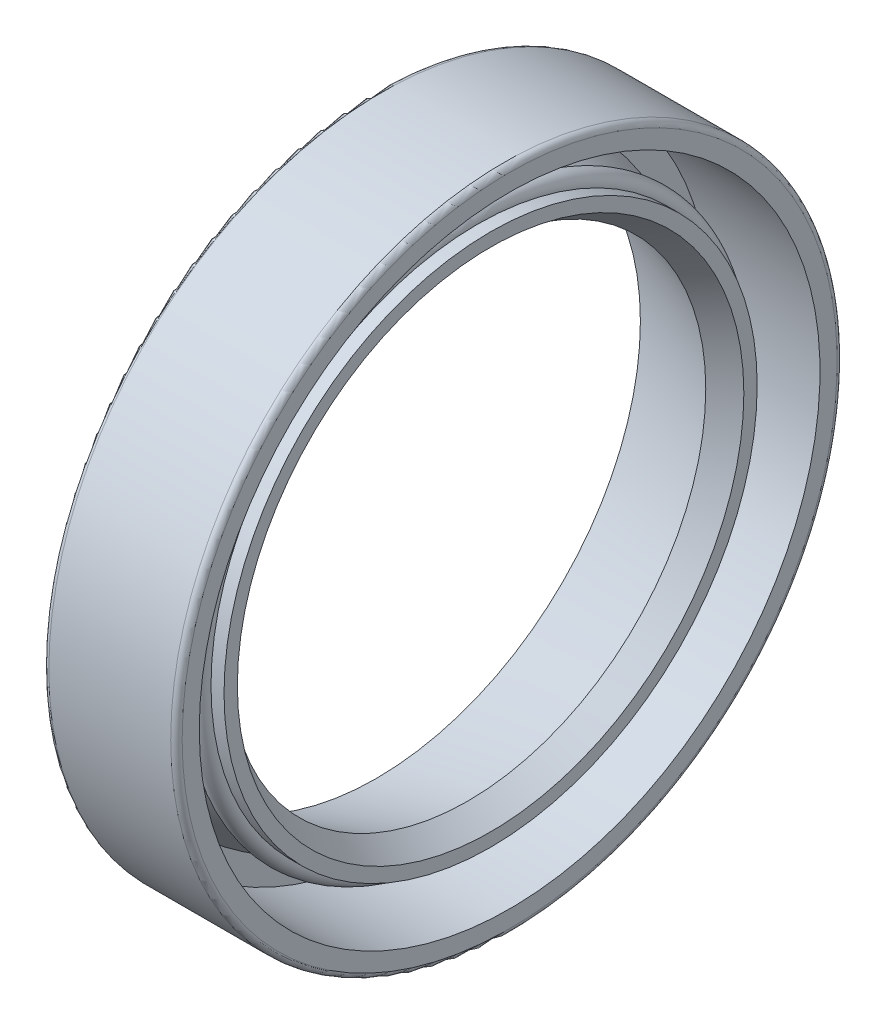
SolidWorks part; units mm, degrees
ref_plane "Plan1" through (0, 0, 0) normal (0, 0, 1) x (1, 0, 0)
ref_plane "Plan2" through (0, 0, 0) normal (0, 1, 0) x (1, 0, 0)
ref_plane "Plan3" through (0, 0, 0) normal (1, 0, 0) x (0, 0, -1)
sketch "Esquisse1" plane through (0, 0, 0) normal (0, 1, 0) x (1, 0, 0)
  line L0 (0, 0) -> (16.6667, 0) construction
  line L1 (0, 13.8667) -> (0, 17.2)
  line L2 (0.3, 17.5) -> (6.7, 17.5)
  line L3 (7, 16.3) -> (1.2, 16.3)
  line L4 (1.2, 16.3) -> (1.2, 14.945)
  line L6 (4.275, 14.1) -> (1.2, 14.945)
  line L12 (7, 16.3) -> (7, 17.2)
  line L14 (0, 13.8667) -> (4.8, 12.5)
  line L15 (4.8, 12.5) -> (6, 13.3)
  line L16 (6, 13.3) -> (6, 14)
  line L17 (6, 14) -> (5.3154, 14)
  arc A0 (0, 17.2) -> (0.3, 17.5) centre (0.3, 17.2) cw
  arc A1 (5.3154, 14) -> (4.275, 14.1) centre (4.8, 14.1) ccw
  arc A2 (6.7, 17.5) -> (7, 17.2) centre (6.7, 17.2) cw
  point P13 (0, 17.5)
  point P22 (7, 17.5)
  dimension "D1" = 35
  dimension "D8" = 0.3
  dimension "D9" = 0.3
  dimension "D2" = 25
  dimension "D3" = 1.2
  dimension "b" = 7
  dimension "D4" = 1.2
  dimension "D5" = 6
revolve "Base-Révolution" add sketch "Esquisse1" angle 360 about L0
